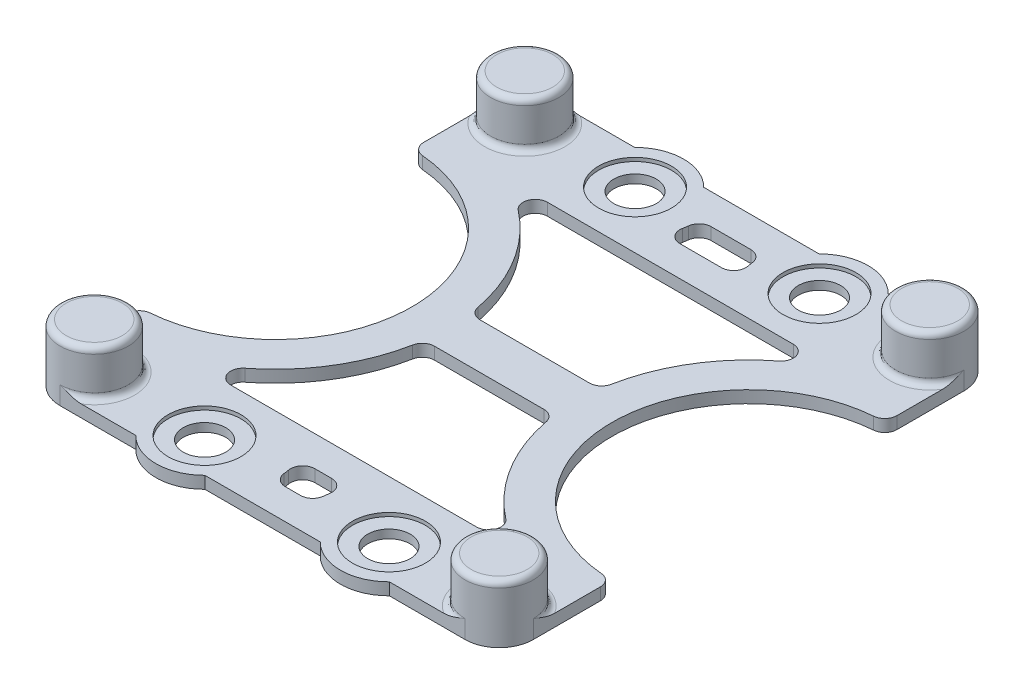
SolidWorks part; units mm, degrees
ref_plane "Front Plane" through (0, 0, 0) normal (0, 0, 1) x (1, 0, 0)
ref_plane "Top Plane" through (0, 0, 0) normal (0, 1, 0) x (1, 0, 0)
ref_plane "Right Plane" through (0, 0, 0) normal (1, 0, 0) x (0, 0, -1)
sketch "Sketch1" plane through (0, 0, 0) normal (0, 1, 0) x (1, 0, 0)
  line L0 (0, 90.0404) -> (0, 0) construction
  line L5 (0, 0) -> (84.6904, 0) construction
  line L6 (84.6904, 0) -> (84.6904, 90.0404) construction
  line L7 (84.6904, 90.0404) -> (61.6333, 90.0404) construction
  line L8 (23.0571, 90.0404) -> (61.6333, 90.0404) construction
  line L9 (61.6333, 90.0404) -> (61.6333, 0) construction
  line L10 (61.6333, 0) -> (23.0571, 0) construction
  line L11 (23.0571, 0) -> (23.0571, 90.0404) construction
  line L12 (61.6333, 90.0404) -> (23.0571, 90.0404) construction
  line L13 (23.0571, 90.0404) -> (0, 90.0404) construction
  dimension "D1" = 84.6904
  dimension "D2" = 90.0404
  dimension "D3" = 23.0571
  dimension "D4" = 23.0571
sketch "Sketch2" plane through (0, 0, 0) normal (0, 1, 0) x (1, 0, 0)
  line L0 (0, -3.9688) -> (84.6904, -3.9687) construction
  line L5 (84.6904, 97.1842) -> (0, 97.1842)
  line L6 (-7.1438, 90.0404) -> (-7.1437, 0)
  line L7 (0, -7.1437) -> (84.6904, -7.1438)
  line L8 (91.8342, 0) -> (91.8342, 90.0404)
  circle A0 centre (0, 90.0404) radius 3.9687
  circle A1 centre (23.0571, 90.0404) radius 3.175
  circle A2 centre (61.6333, 90.0404) radius 3.175
  circle A3 centre (84.6904, 90.0404) radius 3.9687
  circle A4 centre (84.6904, 0) radius 3.9687
  circle A5 centre (61.6333, 0) radius 3.175
  circle A6 centre (23.0571, 0) radius 3.175
  circle A7 centre (0, 0) radius 3.9688
  arc A8 (-7.1437, 0) -> (0, -7.1437) centre (0, 0) ccw
  arc A9 (84.6904, -7.1438) -> (91.8342, 0) centre (84.6904, 0) ccw
  arc A10 (91.8342, 90.0404) -> (84.6904, 97.1842) centre (84.6904, 90.0404) ccw
  arc A11 (0, 97.1842) -> (-7.1438, 90.0404) centre (0, 90.0404) ccw
  arc A12 (84.6904, 97.1842) -> (91.8342, 90.0404) centre (84.6904, 90.0404) ccw construction
  arc A13 (91.8342, 0) -> (78.7505, -3.9687) centre (84.6904, 0) ccw construction
  arc A14 (78.7505, -3.9687) -> (84.6904, -7.1438) centre (84.6904, 0) ccw construction
  arc A15 (5.9399, -3.9687) -> (-7.1437, 0) centre (0, 0) ccw construction
  arc A16 (0, -7.1437) -> (5.9399, -3.9687) centre (0, 0) ccw construction
  arc A17 (-7.1438, 90.0404) -> (0, 97.1842) centre (0, 90.0404) ccw construction
  dimension "D1" = 7.9375
  dimension "D2" = 6.35
  dimension "D3" = 3.175
extrude "Boss-Extrude1" add sketch "Sketch2" along normal blind 2.54 contours L6 A8 L7 A9 L8 A10 L5 A11
sketch "Sketch3" plane through (0, 2.54, 0) normal (0, 1, 0) x (1, 0, 0)
  circle A0 centre (0, 90.0404) radius 7.1437
  circle A1 centre (84.6904, 90.0404) radius 7.1438
  circle A2 centre (84.6904, 0) radius 7.1438
  circle A3 centre (0, 0) radius 7.1437
  circle A4 centre (0, 0) radius 3.9688 construction
  circle A5 centre (84.6904, 0) radius 3.9687 construction
  circle A6 centre (84.6904, 90.0404) radius 3.9687 construction
  circle A7 centre (0, 90.0404) radius 3.9687 construction
  circle A8 centre (0, 0) radius 3.9688
  circle A9 centre (84.6904, 0) radius 3.9687
  circle A10 centre (84.6904, 90.0404) radius 3.9687
  circle A11 centre (0, 90.0404) radius 3.9687
extrude "Boss-Extrude2" add sketch "Sketch3" along normal blind 9.525 contours A2
sketch "Sketch4" plane through (0, 2.54, 0) normal (0, 1, 0) x (1, 0, 0)
  line L0 (-7.1438, 90.0404) -> (-7.1437, 0) construction
  line L2 (91.8342, 0) -> (91.8342, 90.0404) construction
  line L3 (91.8342, 73.5952) -> (-7.1438, 73.5952) construction
  circle A0 centre (-7.1438, 45.0202) radius 28.575
  circle A1 centre (91.8342, 45.0202) radius 28.575
  dimension "D1" = 57.15
extrude "Cut-Extrude1" cut sketch "Sketch4" against normal through all
fillet "Fillet2" radius 1.27 8 edges at (0, 12.065, 7.1437) (84.6904, 12.065, 7.1438) (84.6904, 12.065, -82.8967) (0, 12.065, -82.8967) (5.0514, 2.54, -84.989) (5.0514, 2.54, -5.0514) (79.639, 2.54, -5.0514) (79.639, 2.54, -84.989)
sketch "Sketch9"
  line L0 (-7.1438, 16.4452) -> (-7.1438, 4.445) construction
  line L1 (80.2454, 97.1842) -> (4.445, 97.1842) construction
  circle A0 centre (23.0571, 0) radius 10.16
  circle A1 centre (61.6333, 0) radius 10.16
  circle A2 centre (23.0571, 90.0404) radius 10.16
  circle A3 centre (61.6333, 90.0404) radius 10.16
  circle A4 centre (61.6333, 0) radius 3.175 construction
  circle A8 centre (61.6333, 0) radius 3.175
  circle A9 centre (23.0571, 0) radius 3.175
  circle A10 centre (61.6333, 90.0404) radius 3.175
  circle A11 centre (23.0571, 90.0404) radius 3.175
other "AlignGroup3" parameters "D1"=24.6355, "D4"=6.35, "D5"=6.35, "D6"=6.35, "D2"=0, "D3"=0
other "AlignGroup4"
extrude "Boss-Extrude4" add sketch "Sketch9" against normal up to vertex
sketch "Sketch6" plane through (0, 12.065, 0) normal (0, 1, 0) x (1, 0, 0)
  circle A0 centre (0, 90.0404) radius 3.9687
  circle A1 centre (84.6904, 90.0404) radius 3.9687
  circle A2 centre (84.6904, 0) radius 3.9687
  circle A3 centre (0, 0) radius 3.9688
  circle A4 centre (0, 0) radius 3.9688 construction
extrude "Boss-Extrude3" add sketch "Sketch6" against normal blind 2.54
sketch "Sketch8" plane through (0, 2.54, 0) normal (0, 1, 0) x (1, 0, 0)
  line L0 (7.4694, 78.1342) -> (77.221, 78.1342)
  line L1 (7.4694, 11.9062) -> (77.221, 11.9062)
  line L2 (4.445, -7.1437) -> (15.8326, -7.1437) construction
  line L3 (80.2454, 97.1842) -> (68.8578, 97.1842) construction
  line L4 (28.7366, 49.7827) -> (55.9538, 49.7827)
  line L5 (55.9538, 40.2577) -> (28.7366, 40.2577)
  line L6 (29.0512, 45.0202) -> (55.6392, 45.0202) construction
  line L7 (42.3452, 49.7827) -> (42.3452, 78.1342) construction
  line L8 (42.3452, 40.2577) -> (42.3452, 11.9062) construction
  line L9 (37.2481, 5.5563) -> (47.4423, 5.5563)
  line L11 (46.414, -0.7937) -> (38.2764, -0.7938)
  line L12 (48.9582, 90.8342) -> (35.7322, 90.8342)
  line L13 (42.3452, 78.1342) -> (42.3452, 84.4842) construction
  line L14 (34.4771, 84.4842) -> (50.2133, 84.4842)
  line L15 (38.2971, 0) -> (46.3933, 0) construction
  line L16 (35.7571, 90.0404) -> (48.9333, 90.0404) construction
  line L17 (-7.1438, 16.4452) -> (-7.1438, 4.445) construction
  line L18 (30.2815, -7.1437) -> (54.4089, -7.1438) construction
  arc A0 (91.8342, 81.2152) -> (77.221, 78.1342) centre (91.8342, 45.0202) ccw construction
  arc A1 (7.4694, 78.1342) -> (-7.1438, 81.2152) centre (-7.1438, 45.0202) ccw construction
  arc A2 (77.221, 11.9062) -> (91.8342, 8.8252) centre (91.8342, 45.0202) ccw construction
  arc A3 (-7.1438, 8.8252) -> (7.4694, 11.9062) centre (-7.1438, 45.0202) ccw construction
  arc A4 (29.0512, 45.0202) -> (28.7366, 49.7827) centre (-7.1438, 45.0202) ccw construction
  arc A5 (-7.1438, 8.8252) -> (-7.1438, 81.2152) centre (-7.1438, 45.0202) ccw
  arc A6 (7.4694, 11.9062) -> (28.7366, 40.2577) centre (-7.1438, 45.0202) ccw
  arc A7 (28.7366, 49.7827) -> (7.4694, 78.1342) centre (-7.1438, 45.0202) ccw
  arc A8 (91.8342, 81.2152) -> (91.8342, 8.8252) centre (91.8342, 45.0202) ccw
  arc A9 (77.221, 78.1342) -> (55.9538, 49.7827) centre (91.8342, 45.0202) ccw
  arc A10 (55.9538, 49.7827) -> (55.6392, 45.0202) centre (91.8342, 45.0202) ccw construction
  arc A11 (55.9538, 40.2577) -> (77.221, 11.9062) centre (91.8342, 45.0202) ccw
  arc A12 (55.6392, 45.0202) -> (55.9538, 40.2577) centre (91.8342, 45.0202) ccw construction
  arc A13 (28.7366, 40.2577) -> (29.0512, 45.0202) centre (-7.1438, 45.0202) ccw construction
  arc A14 (48.9582, 90.8342) -> (50.2133, 84.4842) centre (61.6333, 90.0404) ccw
  circle A15 centre (61.6333, 0) radius 3.175 construction
  circle A16 centre (23.0571, 0) radius 3.175 construction
  circle A17 centre (61.6333, 90.0404) radius 3.175 construction
  circle A18 centre (23.0571, 90.0404) radius 3.175 construction
  arc A20 (34.4771, 84.4842) -> (35.7322, 90.8342) centre (23.0571, 90.0404) ccw
  arc A26 (47.4423, 5.5563) -> (46.414, -0.7937) centre (61.6333, 0) ccw
  arc A29 (38.2764, -0.7938) -> (37.2481, 5.5563) centre (23.0571, 0) ccw
  dimension "D8" = 12.7
  dimension "D7" = 15.24
  dimension "D9" = 15.24
  dimension "D3" = 19.05
  dimension "D4" = 19.05
  dimension "D5" = 9.525
  dimension "D6" = 4.7625
  dimension "D11" = 6.35
  dimension "D12" = 6.35
  dimension "D13" = 6.35
  dimension "D14" = 6.35
  dimension "D1" = 7.62
  dimension "D2" = 7.62
extrude "Cut-Extrude3" cut sketch "Sketch8" against normal through all
sketch "Sketch5" plane through (0, 2.54, 0) normal (0, 1, 0) x (1, 0, 0)
  circle A0 centre (23.0571, 90.0404) radius 7.62
  circle A1 centre (61.6333, 90.0404) radius 7.62
  circle A2 centre (61.6333, 0) radius 7.62
  circle A3 centre (23.0571, 0) radius 7.62
  point P2 (23.0571, 90.0404)
  point P5 (61.6333, 90.0404)
  point P8 (66.223, 0)
  point P13 (61.6333, 0)
  point P15 (23.0571, 0)
  dimension "D1" = 15.24
fillet "Fillet3" radius 2.54 20 edges at (7.4694, 1.27, -11.9063) (77.221, 1.27, -11.9063) (55.9538, 1.27, -40.2577) (28.7366, 1.27, -40.2577) (28.7366, 1.27, -49.7827) (55.9538, 1.27, -49.7827) (77.221, 1.27, -78.1342) (7.4694, 1.27, -78.1342) (37.2481, 1.27, -5.5562) (38.2764, 1.27, 0.7938) (46.414, 1.27, 0.7937) (47.4423, 1.27, -5.5562) (48.9582, 1.27, -90.8342) (35.7322, 1.27, -90.8342) (34.4771, 1.27, -84.4842) (50.2133, 1.27, -84.4842) (91.8342, 1.27, -73.5952) (91.8342, 1.27, -16.4452) (-7.1438, 1.27, -16.4452) (-7.1438, 1.27, -73.5952)
extrude "Cut-Extrude4" cut sketch "Sketch5" against normal blind 0.762
sketch "Sketch10" plane through (0, 2.54, 0) normal (0, 1, 0) x (1, 0, 0)
  circle A0 centre (23.0571, 90.0404) radius 4.445
  circle A1 centre (61.6333, 90.0404) radius 4.445
  circle A2 centre (23.0571, 0) radius 4.445
  circle A3 centre (61.6333, 0) radius 4.445
  dimension "D1" = 8.89
extrude "Cut-Extrude5" cut sketch "Sketch10" against normal through all contours A0
